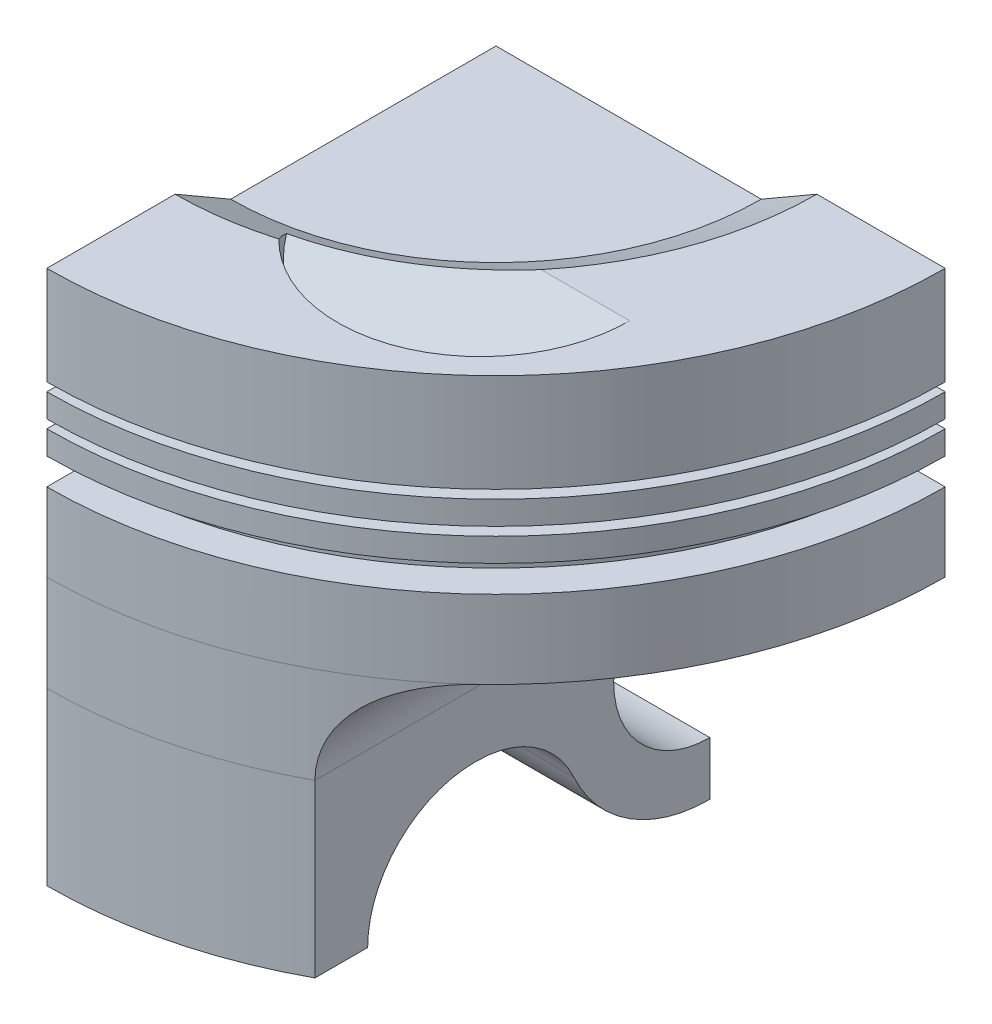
SolidWorks part; units mm, degrees
ref_plane "Спереди" through (0, 0, 0) normal (0, 0, 1) x (1, 0, 0)
ref_plane "Сверху" through (0, 0, 0) normal (0, 1, 0) x (1, 0, 0)
ref_plane "Справа" through (0, 0, 0) normal (1, 0, 0) x (0, 0, -1)
sketch "Эскиз1" plane through (0, 0, 0) normal (0, 1, 0) x (1, 0, 0)
  circle A0 centre (0, 0) radius 42
  dimension "D1" = 84
extrude "Бобышка-Вытянуть1" add sketch "Эскиз1" along normal blind 50
sketch "Эскиз2" plane through (0, 0, 0) normal (0, 0, 1) x (1, 0, 0)
  line L0 (0, 50) -> (0, 0) construction
  line L1 (42, 50) -> (-42, 50) construction
  line L2 (0, 50) -> (0, 47)
  line L3 (0, 47) -> (24.8038, 47)
  line L4 (24.8038, 47) -> (30, 50)
  line L5 (30, 50) -> (0, 50)
  dimension "D1" = 30
  dimension "D2" = 3
  dimension "D3" = 30
revolve "Вырез-Повернуть1" cut sketch "Эскиз2" angle 360 about L0
sketch "Эскиз3" plane through (0, 0, 0) normal (0, 0, 1) x (1, 0, 0)
  line L0 (0, 0) -> (0, 18.2896) construction
  line L1 (42, 0) -> (20, 0)
  line L2 (42, 0) -> (42, 25)
  line L3 (42, 25) -> (20, 25)
  line L4 (20, 0) -> (20, 25)
  line L5 (-20, 0) -> (-20, 25)
  line L6 (-42, 25) -> (-20, 25)
  line L7 (-42, 0) -> (-42, 25)
  line L8 (-42, 0) -> (-20, 0)
  dimension "D1" = 20
  dimension "D2" = 25
extrude "Вырез-Вытянуть1" cut sketch "Эскиз3" against normal through all and the other way through all
sketch "Эскиз4" plane through (0, 0, 0) normal (0, 0, 1) x (1, 0, 0)
  line L0 (42, 25) -> (42, 50) construction
  line L1 (42, 40.8) -> (39, 40.8)
  line L2 (42, 40.8) -> (42, 40)
  line L3 (42, 40) -> (39, 40)
  line L4 (39, 40.8) -> (39, 40)
  line L5 (-20, 0) -> (20, 0) construction
  line L6 (42, 37.8) -> (39, 37.8)
  line L7 (42, 37.8) -> (42, 37)
  line L8 (42, 37) -> (39, 37)
  line L9 (39, 37.8) -> (39, 37)
  line L10 (42, 34.8) -> (39, 34.8)
  line L11 (42, 34.8) -> (42, 32.3)
  line L12 (42, 32.3) -> (39, 32.3)
  line L13 (39, 34.8) -> (39, 32.3)
  line L14 (0, 50) -> (0, 35.6515) construction
  line L15 (30, 50) -> (-30, 50) construction
  dimension "D1" = 0.8
  dimension "D2" = 3
  dimension "D3" = 40
  dimension "D4" = 3
  dimension "D5" = 3
  dimension "D6" = 2.5
revolve "Вырез-Повернуть2" cut sketch "Эскиз4" angle 360 about L14
shell "Оболочка1" thickness 5
sketch "Эскиз5" plane through (0, 0, 0) normal (1, 0, 0) x (0, 0, -1)
  line L0 (30, 50) -> (-30, 50) construction
  line L1 (14, 10) -> (32, 10)
  line L2 (32, 10) -> (32, -10)
  line L3 (32, -10) -> (-32, -10)
  line L4 (0, -10) -> (0, -4) construction
  line L5 (36.9324, 0) -> (-36.9324, 0) construction
  line L6 (-32, 10) -> (-32, -10)
  line L7 (-14, 10) -> (-32, 10)
  circle A0 centre (0, 10) radius 9
  arc A1 (-14, 10) -> (14, 10) centre (0, 10) ccw
  circle A3 centre (0, 10) radius 14 construction
  point P14 (14, 10)
  dimension "D1" = 18
  dimension "D2" = 40
  dimension "D4" = 10
  dimension "D5" = 32
  dimension "D3" = 5
extrude "Вырез-Вытянуть2" cut sketch "Эскиз5" against normal through all and the other way through all
sketch "Эскиз6" plane through (20, 0, 0) normal (1, 0, 0) x (0, 0, -1)
  line L0 (-9.798, 0) -> (9.798, 0)
  arc A0 (-9.798, 0) -> (9.798, 0) centre (0, 10) ccw
  arc A1 (9.798, 0) -> (14, 10) centre (0, 10) ccw construction
extrude "Бобышка-Вытянуть3" add sketch "Эскиз6" against normal blind 5
sketch "Эскиз7" plane through (15, 0, 0) normal (-1, 0, 0) x (0, 0, 1)
  circle A0 centre (0, 10) radius 9
  circle A1 centre (0, 10) radius 14
  arc A2 (-14, 10) -> (14, 10) centre (0, 10) ccw construction
  circle A3 centre (0, 10) radius 9 construction
extrude "Бобышка-Вытянуть4" add sketch "Эскиз7" along normal blind 5
fillet "Скругление1" radius 10 8 edges at (15, 5, -32) (17.5, 10, 14) (17.5, 10, -14) (17.5, 10, -32) (20, 5, -32) (20, 5, 32) (17.5, 10, 32) (15, 5, 32)
mirror "Зеркальное отражение1" about plane through (0, 0, 0) normal (1, 0, 0) of "Скругление1", "Бобышка-Вытянуть4", "Бобышка-Вытянуть3"
sketch "Эскиз8" plane through (0, 0, 0) normal (1, 0, 0) x (0, 0, -1)
  line L0 (-39, 34.8) -> (39, 34.8) construction
  line L1 (-1, 32.3) -> (1, 32.3) construction
  line L2 (-1, 32.3) -> (-1, 34.8) construction
  line L3 (-1, 34.8) -> (1, 34.8) construction
  line L4 (1, 32.3) -> (1, 34.8) construction
  line L5 (-1, 32.3) -> (1, 34.8) construction
  line L6 (-1, 34.8) -> (1, 32.3) construction
  line L7 (42, 32.3) -> (-42, 32.3) construction
  circle A0 centre (0, 33.55) radius 1
  point P0 (0, 33.55)
  dimension "D1" = 2
extrude "Вырез-Вытянуть3" [suppressed] cut sketch "Эскиз8" against normal through all
pattern_circular "Круговой массив1" [suppressed] count 26 over 360
fillet "Скругление2" radius 9 2 edges at (20, 25, 0) (-20, 25, 0)
sketch "Эскиз9" plane through (0, 0, 0) normal (0, 0, 1) x (1, 0, 0)
  line L0 (42, 50) -> (-42, 50) construction
  line L1 (18, 20.05) -> (19, 20.05)
  line L2 (18, 20.05) -> (18, 10)
  line L3 (18, 10) -> (19, 10)
  line L4 (19, 20.05) -> (19, 10)
  line L5 (0, 0) -> (0, 30.0419) construction
  line L6 (-19, 20.05) -> (-19, 10)
  line L7 (-18, 10) -> (-19, 10)
  line L8 (-18, 20.05) -> (-18, 10)
  line L9 (-18, 20.05) -> (-19, 20.05)
  line L10 (-18, 10) -> (18, 10) construction
  dimension "D1" = 10.05
  dimension "D2" = 1
  dimension "D3" = 18
  dimension "D4" = 40
revolve "Вырез-Повернуть3" [suppressed] cut sketch "Эскиз9" angle 360 about L10
sketch "Эскиз10" plane through (0, 0, 0) normal (1, 0, 0) x (0, 0, -1)
  line L0 (42, 0) -> (42, 32.3) construction
  line L1 (36.9324, 0) -> (42, 0) construction
  line L2 (0, 0) -> (0, 16.5) construction
  circle A0 centre (42, 0.5) radius 0.25
  circle A1 centre (42, 1.5) radius 0.25
  circle A2 centre (42, 2.5) radius 0.25
  circle A3 centre (42, 3.5) radius 0.25
  circle A4 centre (42, 4.5) radius 0.25
  circle A5 centre (42, 5.5) radius 0.25
  circle A6 centre (42, 6.5) radius 0.25
  circle A7 centre (42, 7.5) radius 0.25
  circle A8 centre (42, 8.5) radius 0.25
  circle A9 centre (42, 9.5) radius 0.25
  circle A10 centre (42, 10.5) radius 0.25
  circle A11 centre (42, 11.5) radius 0.25
  circle A12 centre (42, 12.5) radius 0.25
  circle A13 centre (42, 13.5) radius 0.25
  circle A14 centre (42, 14.5) radius 0.25
  circle A15 centre (42, 15.5) radius 0.25
  circle A16 centre (42, 16.5) radius 0.25
  circle A17 centre (42, 17.5) radius 0.25
  circle A18 centre (42, 18.5) radius 0.25
  circle A19 centre (42, 19.5) radius 0.25
  dimension "D1" = 0.5
  dimension "D2" = 0.5
  dimension "D3" = 20
revolve "Вырез-Повернуть4" [suppressed] cut sketch "Эскиз10" angle 360 about L2
ref_plane "Плоскость1" through (18, 0, 0) normal (1, 0, 0) x (0, 0, -1)
sketch "Эскиз11" plane through (18, 0, 0) normal (1, 0, 0) x (0, 0, -1)
  line L0 (19, 50) -> (22.1187, 64.6722)
  line L1 (19, 50) -> (32.205, 47.1932)
  line L2 (22.1187, 64.6722) -> (35.3237, 61.8654)
  line L3 (32.205, 47.1932) -> (35.3237, 61.8654)
  line L4 (0, 0) -> (0, 70.2045) construction
  line L5 (30, 50) -> (-30, 50) construction
  dimension "D1" = 13.5
  dimension "D2" = 19
  dimension "D3" = 15
  dimension "D4" = 78
revolve "Вырез-Повернуть5" cut sketch "Эскиз11" angle 360 about L0
mirror "Зеркальное отражение2" about plane through (0, 0, 0) normal (1, 0, 0) of "Вырез-Повернуть5"
mirror "Зеркальное отражение3" about plane through (0, 0, 0) normal (0, 0, 1) of "Зеркальное отражение2", "Вырез-Повернуть5"
chamfer "Фаска1" [suppressed] distance 0.5 angle 45
fillet "Скругление3" [suppressed] radius 0.5
chamfer "Фаска2" [suppressed] distance 0.2 angle 45
sketch "Эскиз13" plane through (0, 0, 0) normal (0, 0, 1) x (1, 0, 0)
  line L0 (-20, -4) -> (-10, -4) construction
  line L1 (-42, 25) -> (42, 25)
  line L2 (-42, 25) -> (-42, -4)
  line L3 (-42, -4) -> (42, -4)
  line L4 (42, 25) -> (42, -4)
  line L5 (42, 25) -> (42, 32.3) construction
sketch "Эскиз15" plane through (0, 0, 0) normal (1, 0, 0) x (0, 0, -1)
  line L0 (-6.7082, 16) -> (-36.9324, 16) construction
  line L1 (-45, 16) -> (45, 16)
  line L2 (-45, 16) -> (-45, -4)
  line L3 (-45, -4) -> (45, -4)
  line L4 (45, 16) -> (45, -4)
  line L6 (0, 0) -> (0, 11.6326) construction
  arc A0 (-12.7268, 4.1667) -> (12.7268, 4.1667) centre (0, 10) ccw construction
  dimension "D1" = 45
sketch "Эскиз17" plane through (0, 0, 0) normal (0, 1, 0) x (1, 0, 0)
  line L0 (0, -46.5707) -> (0, 0)
  line L1 (0, 0) -> (50.1851, 0)
split "Разделить1" trim tools "Эскиз17" bodies to split 121 resulting bodies 123
